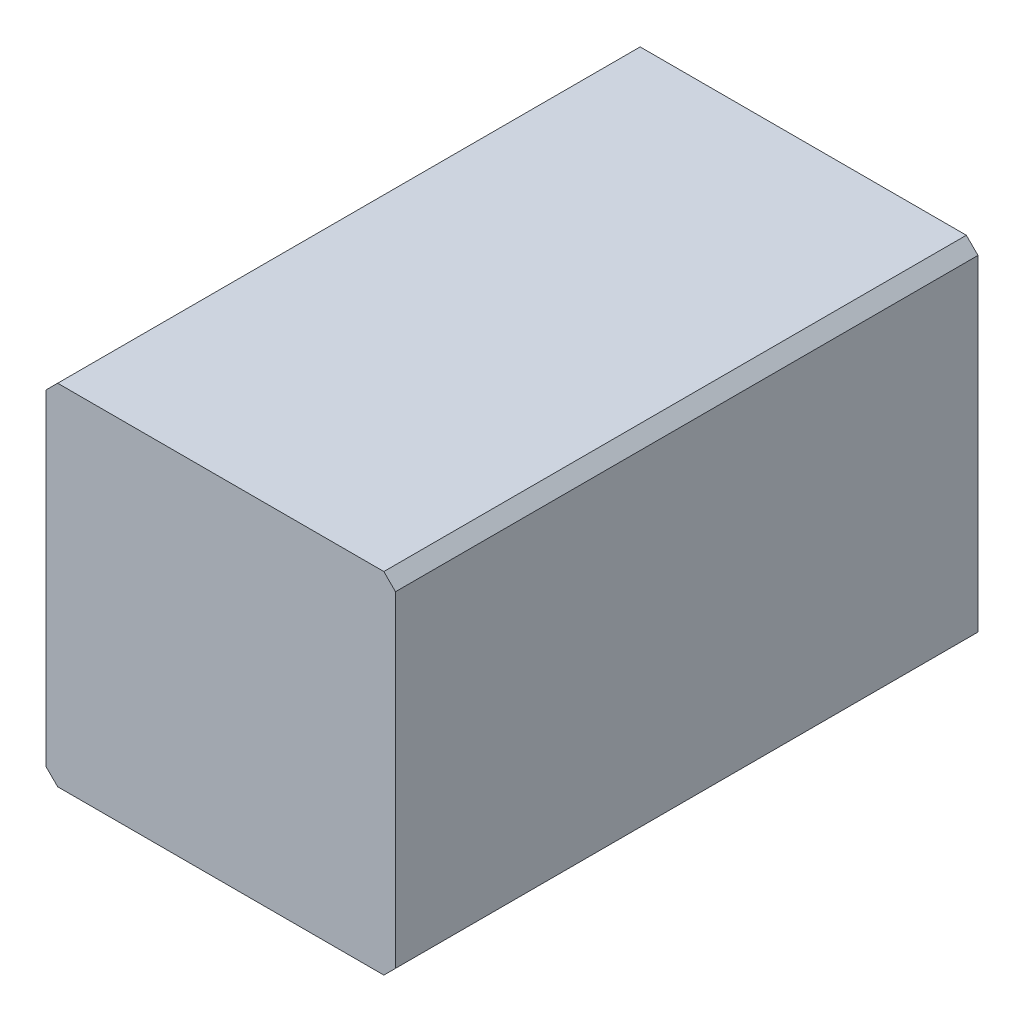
SolidWorks part; units mm, degrees
ref_plane "Face" through (0, 0, 0) normal (0, 0, 1) x (1, 0, 0)
ref_plane "Dessus" through (0, 0, 0) normal (0, 1, 0) x (1, 0, 0)
ref_plane "Droite" through (0, 0, 0) normal (1, 0, 0) x (0, 0, -1)
sketch "Esquisse1" plane through (0, 0, 0) normal (0, 0, 1) x (1, 0, 0)
  line L0 (-3, -3) -> (3, 3) construction
  line L1 (-3, -3) -> (3, -3)
  line L2 (-3, -3) -> (-3, 3)
  line L3 (-3, 3) -> (3, 3)
  line L4 (3, -3) -> (3, 3)
  dimension "D1" = 6
extrude "Extrusion1" add sketch "Esquisse1" along normal mid plane 10
chamfer "Chanfrein1" distance 0.2 angle 45 4 edges at (-3, -3, 0) (3, -3, 0) (-3, 3, 0) (3, 3, 0)
